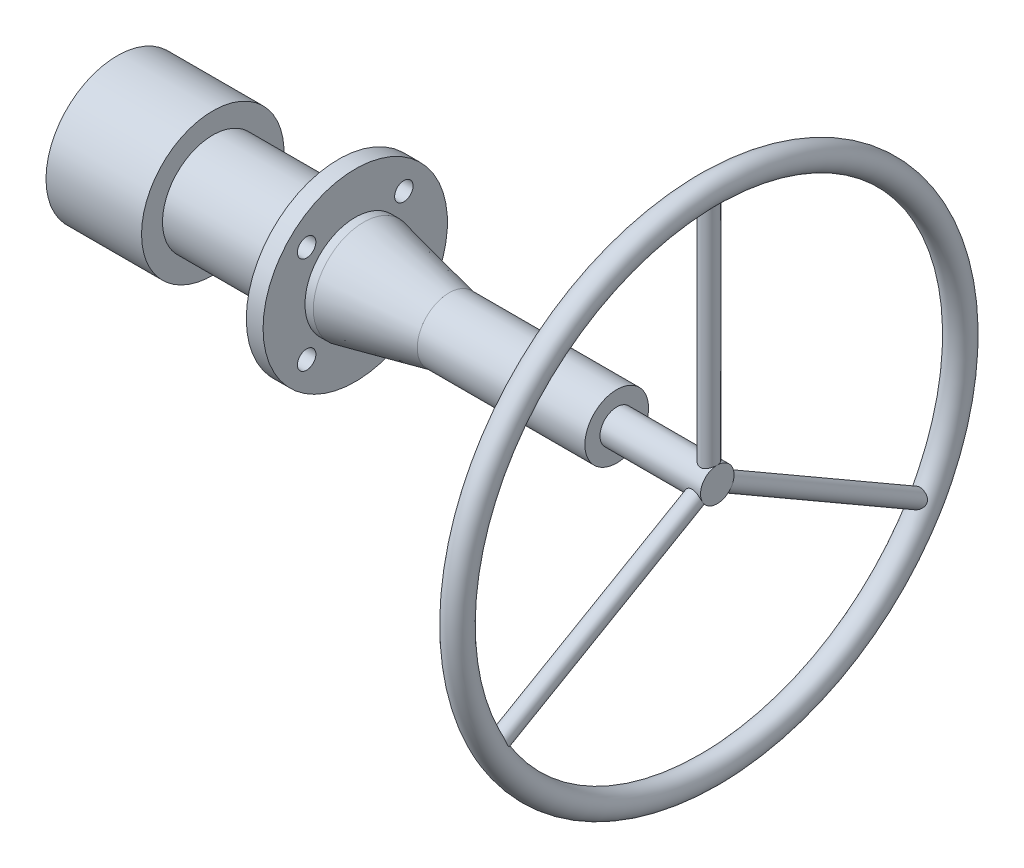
SolidWorks part; units mm, degrees
ref_plane "前视基准面" through (0, 0, 0) normal (0, 0, 1) x (1, 0, 0)
ref_plane "上视基准面" through (0, 0, 0) normal (0, 1, 0) x (1, 0, 0)
ref_plane "右视基准面" through (0, 0, 0) normal (1, 0, 0) x (0, 0, -1)
sketch "草图1" plane through (0, 0, 0) normal (0, 0, 1) x (1, 0, 0)
  line L0 (0, 0) -> (358, 0)
  line L1 (0, 0) -> (0, 42.5)
  line L2 (0, 42.5) -> (57, 42.5)
  line L3 (57, 42.5) -> (57, 30)
  line L4 (57, 30) -> (132, 30)
  line L7 (132, 30) -> (132, 55)
  line L8 (132, 55) -> (142, 55)
  line L9 (142, 55) -> (142, 30)
  line L10 (142, 30) -> (147, 30)
  line L11 (147, 30) -> (198, 19)
  line L12 (198, 19) -> (298, 19)
  line L13 (298, 19) -> (298, 10)
  line L14 (298, 10) -> (358, 10)
  line L15 (358, 10) -> (358, 0)
  dimension "D1" = 42.5
  dimension "D2" = 75
  dimension "D3" = 30
  dimension "D4" = 55
  dimension "D5" = 30
  dimension "D6" = 19
  dimension "D7" = 10
  dimension "D8" = 60
  dimension "D9" = 100
  dimension "D10" = 358
  dimension "D11" = 57
  dimension "D13" = 10
  dimension "D15" = 5
revolve "旋转1" add sketch "草图1" angle 360 about L0
sketch "草图2" plane through (142, 0, 0) normal (1, 0, 0) x (0, 0, -1)
  line L0 (-29, 60.1348) -> (-29, -29) construction
  line L1 (-29, -29) -> (73.4719, -29) construction
  line L2 (-54.4257, 29) -> (29, 29) construction
  line L3 (29, 29) -> (29, -46.9457) construction
  circle A0 centre (-29, 29) radius 5.5
  circle A1 centre (29, 29) radius 5.5
  circle A2 centre (29, -29) radius 5.5
  circle A3 centre (-29, -29) radius 5.5
  dimension "D5" = 11
  dimension "D6" = 11
  dimension "D7" = 11
  dimension "D8" = 11
  dimension "D1" = 29
  dimension "D2" = 29
  dimension "D3" = 58
  dimension "D4" = 58
extrude "切除-拉伸1" cut sketch "草图2" against normal blind 10
ref_plane "基准面1" through (353, 0, 0) normal (1, 0, 0) x (0, 0, -1)
sketch "草图3" plane through (353, 0, 0) normal (1, 0, 0) x (0, 0, -1)
  circle A0 centre (0, 0) radius 150
  dimension "D1" = 300
sketch "草图4" plane through (0, 0, 0) normal (0, 0, 1) x (1, 0, 0)
  line L0 (353, -150) -> (353, 150) construction
  circle A0 centre (353, 150) radius 7.5
  dimension "D1" = 15
  dimension "D2" = 150
sweep "扫描1" add profiles "草图4" path "草图3"
sketch "草图5" plane through (0, 0, 0) normal (0, 1, 0) x (1, 0, 0)
  line L0 (353, -11) -> (353, 11) construction
  circle A0 centre (353, 0) radius 5
  dimension "D1" = 10
extrude "拉伸1" add sketch "草图5" along normal blind 150
pattern_circular "阵列(圆周)1" count 3 over 360 about axis through (0, 0, 0) along (1, 0, 0) of "拉伸1"
